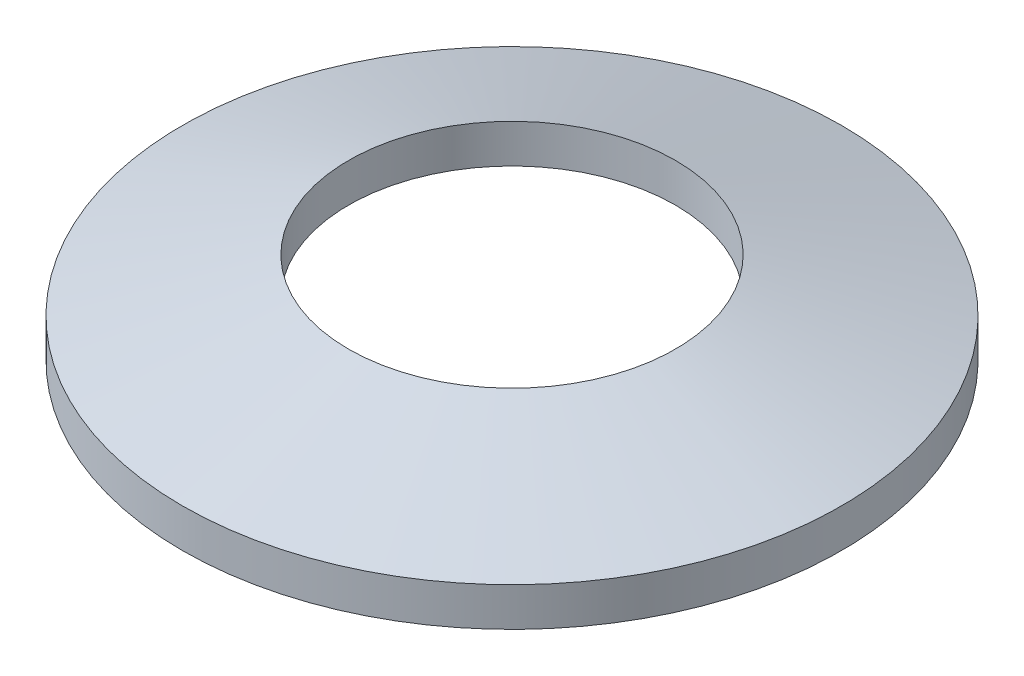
SolidWorks part; units mm, degrees
ref_plane "Plan de face" through (0, 0, 0) normal (0, 0, 1) x (1, 0, 0)
ref_plane "Plan de dessus" through (0, 0, 0) normal (0, 1, 0) x (1, 0, 0)
ref_plane "Plan de droite" through (0, 0, 0) normal (1, 0, 0) x (0, 0, -1)
sketch "Esquisse1" plane through (0, 0, 0) normal (0, 0, 1) x (1, 0, 0)
  line L0 (0, 21.2684) -> (0, -27.4055) construction
  line L1 (-6.25, 0) -> (-3.1, 1)
  line L2 (-3.1, 1) -> (-3.1, 1.7344)
  line L3 (-3.1, 1.7344) -> (-6.25, 0.7344)
  line L4 (-6.25, 0.7344) -> (-6.25, 0)
  dimension "D1" = 6.2
  dimension "D2" = 12.5
  dimension "D3" = 0.7
  dimension "D4" = 1
revolve "Révolution1" add sketch "Esquisse1" angle 360 about L0
